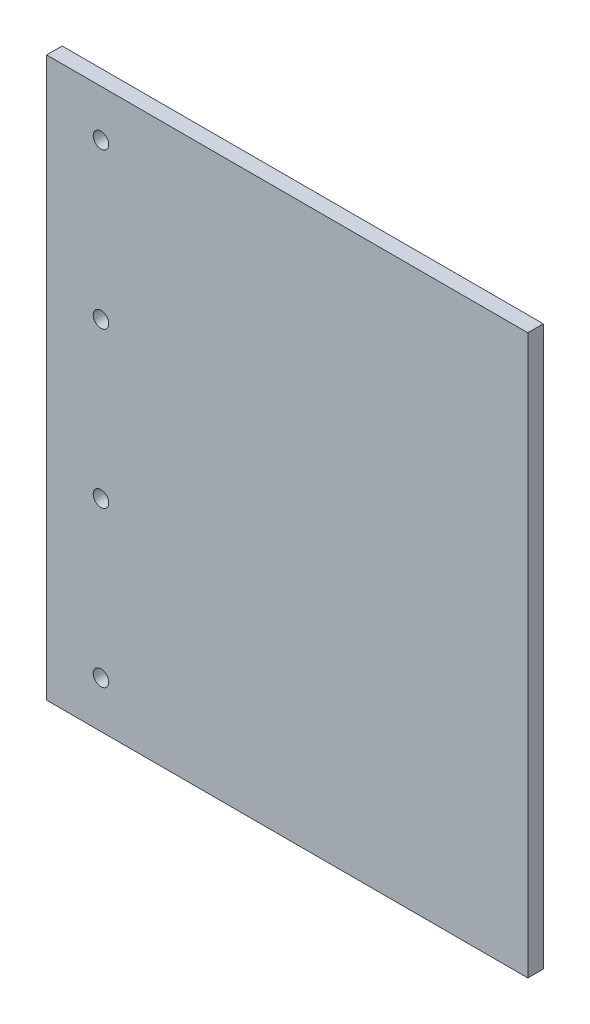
SolidWorks part; units mm, degrees
ref_plane "Front Plane" through (0, 0, 0) normal (0, 0, 1) x (1, 0, 0)
ref_plane "Top Plane" through (0, 0, 0) normal (0, 1, 0) x (1, 0, 0)
ref_plane "Right Plane" through (0, 0, 0) normal (1, 0, 0) x (0, 0, -1)
sketch "Sketch1" plane through (0, 0, 0) normal (0, 0, 1) x (1, 0, 0)
  line L1 (0, 0) -> (393.7, 0)
  line L2 (0, 0) -> (0, 457.2)
  line L3 (0, 457.2) -> (393.7, 457.2)
  line L4 (393.7, 0) -> (393.7, 457.2)
  dimension "D1" = 393.7
  dimension "D2" = 457.2
extrude "Plate" add sketch "Sketch1" along normal blind 12.7
hole_wizard "Hole" positions "Sketch4" profile "Sketch3" hole size "1/2" standard "Ansi Inch"
sketch "Sketch4" plane through (0, 0, 12.7) normal (0, 0, 1) x (1, 0, 0)
  line L0 (0, 457.2) -> (0, 0) construction
  line L1 (0, 0) -> (393.7, 0) construction
  point P0 (44.45, 38.1)
  dimension "D1" = 44.45
  dimension "D2" = 38.1
sketch "Sketch3" plane through (44.45, 38.1, 12.7) normal (1, 0, 0) x (0, -1, 0)
  line L0 (0, 0) -> (0, 29.2155)
  line L1 (0, 29.2155) -> (6.35, 25.4)
  line L2 (6.35, 25.4) -> (6.35, 0)
  line L5 (6.35, 0) -> (0, 0)
  line L10 (0, 29.2155) -> (-6.35, 25.4) construction
  line L11 (0, -6.35) -> (0, 107.95) construction
  dimension "Hole Dia." = 12.7
  dimension "Hole Depth" = 25.4
  dimension "Drill Angle" = 118
pattern_linear "Standard Linear" count 4 spacing 127 along (0, 1, 0) of "Hole"
